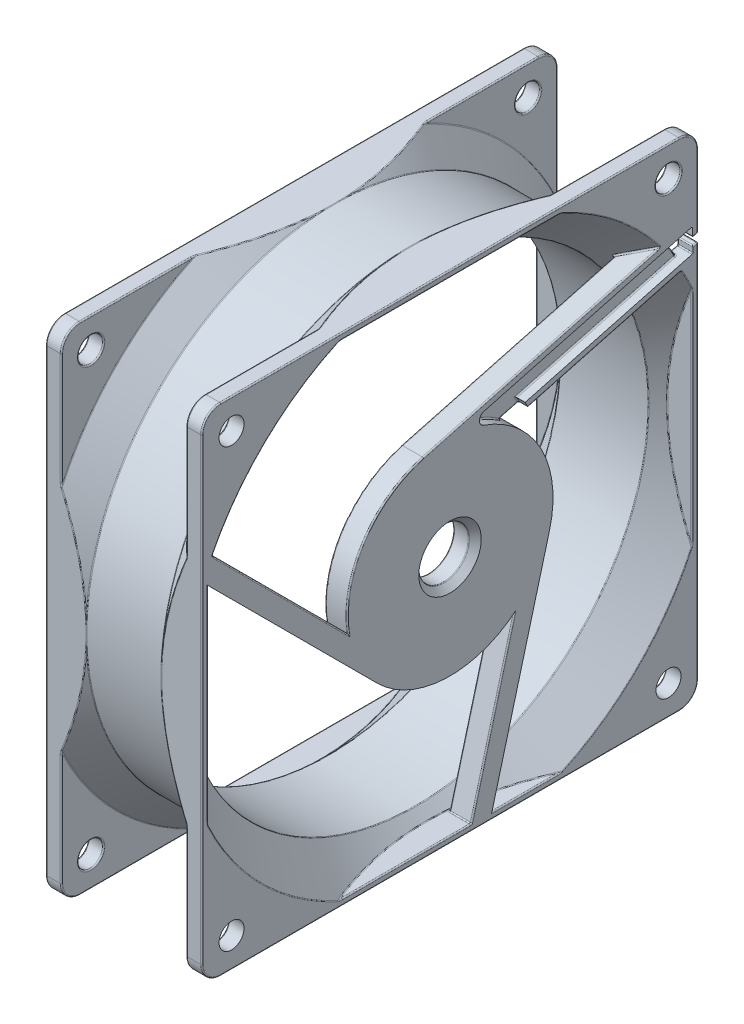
SolidWorks part; units mm, degrees
ref_plane "Front Plane" through (0, 0, 0) normal (0, 0, 1) x (1, 0, 0)
ref_plane "Top Plane" through (0, 0, 0) normal (0, 1, 0) x (1, 0, 0)
ref_plane "Right Plane" through (0, 0, 0) normal (1, 0, 0) x (0, 0, -1)
sketch "Sketch1" plane through (0, 0, 0) normal (0, 0, 1) x (1, 0, 0)
  line L0 (0, 0) -> (37.156, 0) construction
  line L1 (0, 39.75) -> (6, 39.75)
  line L2 (6, 39.75) -> (10, 43.75)
  line L3 (10, 43.75) -> (10, 56.4923)
  line L4 (0, 37.25) -> (7.0355, 37.25)
  line L5 (7.0355, 37.25) -> (12.5, 42.7145)
  line L6 (12.5, 42.7145) -> (12.5, 56.4923)
  line L7 (10, 56.4923) -> (12.5, 56.4923)
  line L8 (0, 0) -> (0, 20.0873) construction
  line L9 (-12.5, 42.7145) -> (-12.5, 56.4923)
  line L10 (-7.0355, 37.25) -> (-12.5, 42.7145)
  line L11 (-6, 39.75) -> (-10, 43.75)
  line L12 (-10, 43.75) -> (-10, 56.4923)
  line L13 (-12.5, 56.4923) -> (-10, 56.4923)
  line L14 (-6, 39.75) -> (0, 39.75)
  line L15 (-7.0355, 37.25) -> (0, 37.25)
  dimension "D1" = 39.75
  dimension "D2" = 4
  dimension "D3" = 135
  dimension "D5" = 25
  dimension "D4" = 2.5
revolve "Revolve1" add sketch "Sketch1" angle 360 about L0
sketch "Sketch2" plane through (12.5, 0, 0) normal (1, 0, 0) x (0, 0, -1)
  line L1 (-39.75, 39.75) -> (39.75, 39.75)
  line L2 (-39.75, 39.75) -> (-39.75, -39.75)
  line L3 (-39.75, -39.75) -> (39.75, -39.75)
  line L4 (39.75, 39.75) -> (39.75, -39.75)
  line L5 (-71.0416, 64.4374) -> (64.0601, 64.4374)
  line L6 (-71.0416, 64.4374) -> (-71.0416, -60.475)
  line L7 (-71.0416, -60.475) -> (64.0601, -60.475)
  line L8 (64.0601, 64.4374) -> (64.0601, -60.475)
  circle A0 centre (0, 0) radius 39.75 construction
extrude "Cut-Extrude1" cut sketch "Sketch2" against normal through all
sketch "Sketch3" plane through (12.5, 0, 0) normal (1, 0, 0) x (0, 0, -1)
  line L0 (-16.6649, 39.75) -> (16.4993, 39.75)
  line L3 (-15.6353, 39.75) -> (-39.75, 39.75) construction
  line L4 (39.75, 39.75) -> (15.6353, 39.75) construction
  line L5 (16.4993, 39.75) -> (17.9712, 38.75)
  line L6 (17.9712, 38.75) -> (-17.9712, 38.75)
  line L7 (-17.9712, 38.75) -> (-16.6649, 39.75)
  arc A1 (39.75, 15.6353) -> (15.6353, 39.75) centre (0, 0) ccw construction
  arc A2 (-15.6353, 39.75) -> (-39.75, 15.6353) centre (0, 0) ccw construction
  dimension "D1" = 1
extrude "Extrude4" add sketch "Sketch3" against normal up to surface
pattern_circular "CirPattern1" count 4 over 360 about axis through (0, 0, 0) along (1, 0, 0) of "Extrude4"
sketch "Sketch4" plane through (-12.5, 0, 0) normal (-1, 0, 0) x (0, 0, 1)
  line L0 (-17.9712, 39.75) -> (17.9712, 39.75)
  line L2 (-39.75, 39.75) -> (-15.6353, 39.75) construction
  line L3 (15.6353, 39.75) -> (39.75, 39.75) construction
  line L4 (17.9712, 39.75) -> (17.9712, 38.75)
  line L5 (17.9712, 38.75) -> (-17.9712, 38.75)
  line L6 (-17.9712, 38.75) -> (-17.9712, 39.75)
  arc A1 (39.75, 15.6353) -> (15.6353, 39.75) centre (0, 0) ccw construction
  arc A2 (-15.6353, 39.75) -> (-39.75, 15.6353) centre (0, 0) ccw construction
  dimension "D1" = 1
extrude "Extrude6" add sketch "Sketch4" against normal up to surface
pattern_circular "CirPattern2" count 4 over 360 about axis through (0, 0, 0) along (1, 0, 0) of "Extrude6"
sketch "Sketch7" plane through (-12.5, 0, 0) normal (-1, 0, 0) x (0, 0, 1)
  line L2 (0, 0) -> (35, 35) construction
  line L3 (0, 0) -> (39.75, 0) construction
  line L4 (39.75, 39.75) -> (39.75, -39.75) construction
  circle A0 centre (35, 35) radius 2
  dimension "D1" = 4
  dimension "D2" = 35
  dimension "D3" = 45
extrude "Screw Hole" cut sketch "Sketch7" against normal through all
pattern_circular "CirPattern4" count 4 over 360 about axis through (0, 0, 0) along (1, 0, 0) of "Screw Hole"
fillet "Fillet1" radius 3 6 edges at (-11.25, 39.75, 39.75) (-11.25, 39.75, -39.75) (-11.25, -39.75, -39.75) (11.25, 39.75, 39.75) (11.25, -39.75, 39.75) (-11.25, -39.75, 39.75)
sketch "Sketch8" plane through (12.5, 0, 0) normal (1, 0, 0) x (0, 0, -1)
  line L0 (33.7859, 26.135) -> (-4.2705, 15.9378)
  line L1 (39.75, -36.75) -> (39.75, 36.75) construction
  line L2 (15.9378, -4.2705) -> (6.699, -38.75)
  line L3 (17.9712, -38.75) -> (-17.9712, -38.75) construction
  line L4 (3.412, -38.75) -> (10.3524, -12.8483)
  line L5 (0, 0) -> (39.75, 0) construction
  line L6 (17.9712, -38.75) -> (-17.9712, -38.75) construction
  line L7 (6.699, -38.75) -> (3.412, -38.75)
  line L8 (35.5406, 23.6937) -> (5.3573, 15.6061) construction
  line L9 (5.0555, -38.75) -> (12.5767, -10.6807) construction
  line L10 (-11.6673, -11.6673) -> (-38.75, 15.4155)
  line L11 (-38.75, -17.9712) -> (-38.75, 17.9712) construction
  line L12 (-38.75, 19.9056) -> (-16.3031, -2.5413)
  line L13 (-38.75, 15.4155) -> (-38.75, 19.9056)
  line L14 (-38.75, 17.6605) -> (-15.5381, -5.5514) construction
  line L15 (9.2457, 13.6663) -> (37.1192, 21.135)
  arc A0 (-4.2705, 15.9378) -> (-16.3031, -2.5413) centre (0, 0) ccw
  arc A1 (33.7859, 26.135) -> (37.1192, 21.135) centre (0, 0) cw
  arc A2 (15.9378, -4.2705) -> (9.2457, 13.6663) centre (0, 0) ccw
  arc A3 (-11.6673, -11.6673) -> (10.3524, -12.8483) centre (0, 0) ccw
  arc A5 (38.75, 17.9712) -> (17.9712, 38.75) centre (0, 0) ccw construction
  dimension "D1" = 5
  dimension "D2" = 15
  dimension "D3" = 33
  dimension "D4" = 3.175
  dimension "D5" = 105
  dimension "D6" = 3.175
  dimension "D7" = 120
extrude "Extrude8" add sketch "Sketch8" against normal blind 3.5
sketch "Sketch9" plane through (9, 0, 0) normal (-1, 0, 0) x (0, 0, 1)
  circle A0 centre (0, 0) radius 4
  dimension "D1" = 8
extrude "Cut-Extrude5" cut sketch "Sketch9" against normal through all
chamfer "Chamfer1" distance 1 angle 45 1 edges at (12.5, 0, 4)
sketch "Sketch10" plane through (12.5, 0, 0) normal (1, 0, 0) x (0, 0, -1)
  line L0 (5.4524, 17.5077) -> (38.8575, 26.4586)
  line L1 (12.0318, 15.4481) -> (38.9085, 22.6497)
  line L2 (9.2457, 13.6663) -> (37.1192, 21.135) construction
  line L3 (38.8575, 26.4586) -> (38.8575, 24.8632)
  line L4 (12.0318, 15.4481) -> (14.1114, 11.4608)
  line L5 (14.1114, 11.4608) -> (12.949, 10.2261)
  line L6 (33.7859, 26.135) -> (-4.2705, 15.9378) construction
  line L8 (38.8575, 24.8632) -> (39.75, 25.1024)
  line L9 (39.75, -36.75) -> (39.75, 36.75) construction
  line L10 (39.75, 25.1024) -> (39.75, 23.9181)
  line L11 (39.75, 23.9181) -> (38.9085, 23.6926)
  line L12 (38.9085, 23.6926) -> (38.9085, 22.6497)
  arc A0 (12.949, 10.2261) -> (5.3849, 15.5966) centre (0, 0) ccw
  arc A2 (5.4524, 17.5077) -> (5.3849, 15.5966) centre (5.7112, 16.5418) ccw
  arc A3 (15.9378, -4.2705) -> (9.2457, 13.6663) centre (0, 0) ccw construction
  dimension "D3" = 1
  dimension "D1" = 1
  dimension "D2" = 1
extrude "Cut-Extrude6" cut sketch "Sketch10" against normal blind 1.5
sketch "Sketch11" plane through (11, 0, 0) normal (1, 0, 0) x (0, 0, -1)
  line L10 (12.5056, 14.5397) -> (12.0318, 15.4481)
  line L11 (12.0318, 15.4481) -> (38.9085, 22.6497)
  line L12 (38.9085, 22.6497) -> (38.9085, 23.6926)
  line L13 (38.9085, 23.6926) -> (39.75, 23.9181)
  line L14 (39.75, 23.9181) -> (39.75, 25.1024)
  line L15 (39.75, 25.1024) -> (38.8575, 24.8632)
  line L16 (38.8575, 24.8632) -> (38.8575, 26.4586)
  line L17 (38.8575, 26.4586) -> (5.4524, 17.5077)
  line L18 (9.2457, 13.6663) -> (12.5056, 14.5397)
  line L20 (37.635, 22.3084) -> (38.9085, 22.6497)
  line L21 (38.9085, 22.6497) -> (38.9085, 23.6926)
  line L22 (38.9085, 23.6926) -> (39.75, 23.9181)
  line L23 (39.75, 23.9181) -> (39.75, 25.1024)
  line L24 (39.75, 25.1024) -> (38.8575, 24.8632)
  line L25 (38.8575, 24.8632) -> (38.8575, 26.4586)
  line L26 (38.8575, 26.4586) -> (35.5065, 25.5607)
  arc A0 (39.75, 18.2757) -> (18.2757, 39.75) centre (0, 0) ccw construction
  arc A5 (37.635, 22.3084) -> (35.5065, 25.5607) centre (0, 0) ccw
  arc A6 (5.4524, 17.5077) -> (5.3849, 15.5966) centre (5.7112, 16.5418) ccw
  arc A7 (9.2457, 13.6663) -> (5.3849, 15.5966) centre (0, 0) ccw
  dimension "D1" = 0
extrude "Cut-Extrude7" cut sketch "Sketch11" against normal up to surface (1 mm away)
sketch "Sketch12" plane through (0, 0, -39.75) normal (0, 0, -1) x (-1, 0, 0)
  line L0 (10, 39.75) -> (10, 18.2757) construction
  line L1 (10, 13.5) -> (-10, 13.5)
  line L2 (10, 13.5) -> (10, -13.5)
  line L3 (10, -13.5) -> (-10, -13.5)
  line L4 (-10, 13.5) -> (-10, -13.5)
  line L6 (-10, -36.75) -> (-10, -18.2757) construction
  dimension "D1" = 13.5
  dimension "D2" = 13.5
extrude "Extrude9" add sketch "Sketch12" against normal up to body draft 45 separate body
fillet "Fillet2" radius 0.2 166 edges at (12.5, 33.3922, -26.6361) (12.5, 38.75, 0) (7.0355, 0, 37.25) (8.5563, 38.75, -1.2695) (12.5, -1.2778, 38.75) (8.5563, -1.2695, 38.75) (-7.0355, 0, 37.25) (12.5, -30.2037, 30.2037) (12.5, -38.75, -12.3351) (12.5, -30.2037, -30.2037) (12.5, 0, -38.75) (8.5563, -1.2695, -38.75) (-12.5, 30.2037, -30.2037) (-12.5, 38.75, 0) (-8.5563, 38.75, -1.2695) (-10, 30.9359, 30.9359) (-12.5, 30.2037, 30.2037) (-6, 28.1075, 28.1075) (-12.5, 0, 38.75) (-8.5563, -1.2695, 38.75) (-12.5, -30.2037, 30.2037) (-12.5, -38.75, 0) (-8.5563, -38.75, -1.2695) (-12.5, -30.2037, -30.2037) (-12.5, 0, -38.75) (-8.5563, -1.2695, -38.75) (-10, 35, 37) (10, 35, 33) (-12.5, 35, 37) (-10, -35, 37) (10, -35, 33) (-12.5, -37, 35) (-10, -35, -33) (10, -35, -37) (-12.5, -35, -37) (-10, 35, -33) (12.5, 35, -33) (10, 35, -37) (-12.5, 37, -35) (-12.5, 0, -39.75) (-10, 27.5128, -39.75) (-10, 38.8713, -38.8713) (-12.5, 39.75, 0) (-10, 39.75, 27.5128) (-12.5, -39.75, 0) (-12.5, 0, 39.75) (-12.5, 38.8713, 38.8713) (-12.5, -38.8713, 38.8713) (-12.5, -38.8713, -38.8713) (-12.5, 38.8713, -38.8713) (12.5, -6.416, -39.75) (10, -27.5128, -39.75) (12.5, -39.75, 0) (12.5, 39.75, 0) (12.5, 0, 39.75) (12.5, -38.8713, 38.8713) (12.5, 38.8713, 38.8713) (12.5, -38.8713, -38.8713) (12.5, 38.8713, -38.8713) (10, 39.75, -27.5128) (10, 38.8713, -38.8713) (10, -39.75, 27.5128) (10, -38.8713, -38.8713) (-10, -39.75, -27.5128) (-10, -38.8713, -38.8713) (10, 27.5128, 39.75) (10, 38.8713, 38.8713) (10, -38.8713, 38.8713) (-10, -27.5128, 39.75) (-10, -38.8713, 38.8713) (-10, 38.8713, 38.8713) (12.5, -38.75, 7.2796) (-6, 33.7664, -20.9735) (12.5, 19.5701, -37.9676) (12.5, 30.7113, 29.6874) (-6, -28.1075, 28.1075) (9, 16.931, -21.4299) (9, -38.75, -4.7148) (9, 7.0577, 25.9021) (9, 20.5414, -12.9105) (9, 0.9101, 24.2446) (9, -21.4515, -11.3341) (9, -38.6929, -6.3743) (9, 22.7387, -31.9488) (12.5, 8.3665, 27.2109) (6, 33.7664, -20.9735) (12.5, -25.7991, -6.8822) (12.5, 21.0364, -14.7577) (9, 5.7677, -15.4591) (10, 13.6663, -9.2457) (9, -25.7991, -6.8822) (10.75, -38.75, -3.412) (9, -16.4763, 0.8837) (6, -28.1075, 28.1075) (9, 9.0035, 13.8271) (9, 15.0866, 36.1963) (9, 0, 4) (11.5, 0, 4) (12.5, 17.8374, -24.8124) (11, 14.103, -10.8756) (11.75, 14.5397, -12.5056) (12.5, 30.9262, -39.75) (11, 14.7582, -7.3787) (11, 16.5771, -4.7118) (11.25, 26.4586, -38.8575) (11.25, 24.8632, -38.8575) (11.25, 25.1024, -39.75) (11.25, 23.9181, -39.75) (11.25, 23.6926, -38.9085) (11, 18.8783, -24.8334) (11.25, 22.6497, -38.9085) (11, 14.9939, -12.2687) (12.5, 23.8053, -39.3293) (12.5, 24.9828, -39.3038) (11, 21.5342, -20.4795) (10, 30.9262, -39.75) (10.5, 22.3084, -37.635) (10.5, 25.5607, -35.5065) (11, 23.9582, -36.6069) (10, 24.9828, -39.3038) (10, 23.8053, -39.3293) (-6, -33.7664, -20.9735) (6, -33.7664, -20.9735) (0, -13.5, -39.75) (0, -17.6172, -35.6328) (0, 13.5, -39.75) (0, 17.6172, -35.6328) (-10, 30.9359, -30.9359) (-10, -30.9359, -30.9359) (-10, -30.9359, 30.9359) (10, -27.5128, 39.75) (10, 39.75, 27.5128) (10, 21.0969, -39.75) (10, -39.75, -27.5128) (-10, 27.5128, 39.75) (-10, 39.75, -27.5128) (-10, -27.5128, -39.75) (-10, -39.75, 27.5128) (6, 28.1075, 28.1075)
fillet "Fillet3" radius 0.2 11 edges at (10.0782, 23.6609, -38.9499) (10.0586, 24.9507, -38.9575) (10, 25.6609, -38.8575) (10, 26.3566, -38.7793) (10, 26.0133, -37.1955) (10, 25.51, -35.6489) (10, 23.9009, -36.6444) (10, 22.3555, -37.6543) (10, 22.4788, -38.2708) (10, 22.6814, -38.8672) (10, 23.1443, -38.9085)
fillet "Fillet4" radius 0.2 4 edges at (10.1219, 22.3272, -37.6982) (10.0978, 18.5307, -39.7219) (10.0147, 18.5793, -39.6252) (10, 20.4429, -38.6801)
